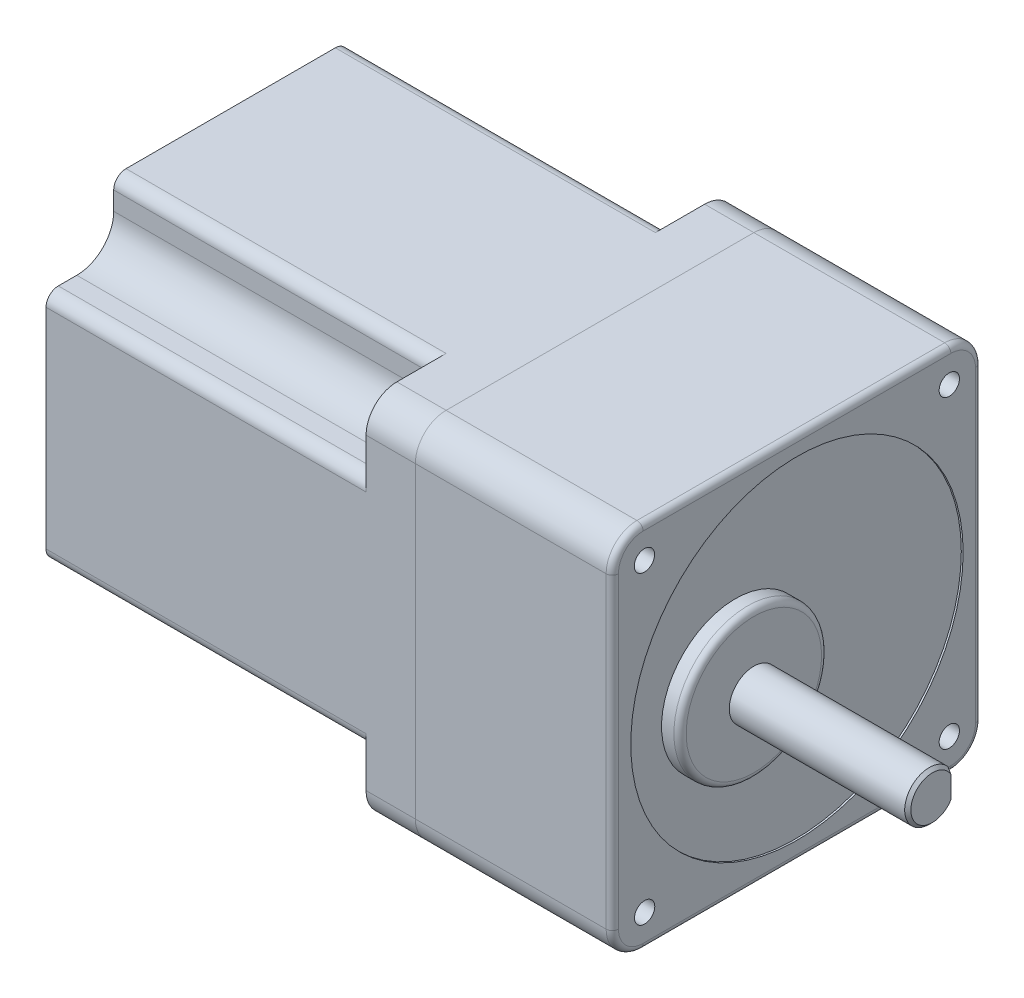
SolidWorks part; units mm, degrees
ref_plane "前视基准面" through (0, 0, 0) normal (0, 0, 1) x (1, 0, 0)
ref_plane "上视基准面" through (0, 0, 0) normal (0, 1, 0) x (1, 0, 0)
ref_plane "右视基准面" through (0, 0, 0) normal (1, 0, 0) x (0, 0, -1)
sketch "草图1" plane through (0, 0, 0) normal (1, 0, 0) x (0, 0, -1)
  line L1 (-25, -30) -> (25, -30)
  line L2 (-30, -25) -> (-30, 25)
  line L3 (-25, 30) -> (25, 30)
  line L4 (30, -25) -> (30, 25)
  line L5 (-30, -30) -> (30, 30) construction
  line L6 (-30, 30) -> (30, -30) construction
  arc A0 (-25, -30) -> (-30, -25) centre (-25, -25) cw
  arc A1 (25, -30) -> (30, -25) centre (25, -25) ccw
  arc A2 (25, 30) -> (30, 25) centre (25, 25) cw
  arc A3 (-30, 25) -> (-25, 30) centre (-25, 25) cw
  point P0 (0, 0)
  dimension "D1" = 5
extrude "凸台-拉伸1" add sketch "草图1" against normal blind 8
sketch "草图3" plane through (0, 0, 0) normal (1, 0, 0) x (0, 0, -1)
  circle A5 centre (-24.7487, 24.7487) radius 3
  circle A6 centre (24.7487, 24.7487) radius 3
  circle A7 centre (24.7487, -24.7487) radius 3
  circle A8 centre (-24.7487, -24.7487) radius 3
extrude "切除-拉伸1" cut sketch "草图3" against normal blind 8
sketch "草图4" plane through (-8, 0, 0) normal (-1, 0, 0) x (0, 0, 1)
  line L0 (-25, 19) -> (-28, 19)
  line L1 (-30, -25) -> (-30, 25) construction
  line L2 (-30, 17) -> (-30, -17)
  line L3 (-25, -19) -> (-28, -19)
  line L4 (-17, -30) -> (17, -30)
  line L5 (-19, -25) -> (-19, -28)
  line L6 (25, -30) -> (-25, -30) construction
  line L7 (30, -17) -> (30, 17)
  line L8 (19, -25) -> (19, -28)
  line L9 (-17, 30) -> (17, 30)
  line L10 (25, -19) -> (28, -19)
  line L11 (30, 25) -> (30, -25) construction
  line L13 (25, 19) -> (28, 19)
  line L15 (19, 25) -> (19, 28)
  line L16 (-25, 30) -> (25, 30) construction
  line L18 (-19, 25) -> (-19, 28)
  arc A0 (-25, 19) -> (-19, 25) centre (-25, 25) ccw
  arc A1 (19, 25) -> (25, 19) centre (25, 25) ccw
  arc A2 (-19, -25) -> (-25, -19) centre (-25, -25) ccw
  arc A3 (25, -19) -> (19, -25) centre (25, -25) ccw
  arc A4 (-19, 28) -> (-17, 30) centre (-17, 28) cw
  arc A5 (19, 28) -> (17, 30) centre (17, 28) ccw
  arc A6 (28, 19) -> (30, 17) centre (28, 17) cw
  arc A7 (28, -19) -> (30, -17) centre (28, -17) ccw
  arc A8 (19, -28) -> (17, -30) centre (17, -28) cw
  arc A9 (-19, -28) -> (-17, -30) centre (-17, -28) ccw
  arc A10 (-28, -19) -> (-30, -17) centre (-28, -17) cw
  arc A11 (-30, 17) -> (-28, 19) centre (-28, 17) cw
  point P7 (-19, 30)
  point P37 (19, 30)
  point P40 (30, 19)
  point P43 (30, -19)
  point P46 (19, -30)
  point P49 (-19, -30)
  point P52 (-30, -19)
  point P55 (-30, 19)
  dimension "D1" = 2
extrude "凸台-拉伸2" add sketch "草图4" along normal blind 52
sketch "草图5" plane through (0, 0, 0) normal (1, 0, 0) x (0, 0, -1)
  line L0 (25, 30) -> (-25, 30) construction
  line L1 (-25, -30) -> (25, -30)
  line L2 (-30, -25) -> (-30, 25)
  line L3 (-25, 30) -> (25, 30)
  line L4 (30, -25) -> (30, 25)
  line L5 (-30, -30) -> (30, 30) construction
  line L6 (-30, 30) -> (30, -30) construction
  arc A0 (-25, -30) -> (-30, -25) centre (-25, -25) cw
  arc A1 (25, -30) -> (30, -25) centre (25, -25) ccw
  arc A2 (25, 30) -> (30, 25) centre (25, 25) cw
  arc A3 (-30, 25) -> (-25, 30) centre (-25, 25) cw
  point P0 (0, 0)
  dimension "D1" = 5
extrude "凸台-拉伸3" add sketch "草图5" along normal blind 32 separate body
sketch "草图6" plane through (32, 0, 0) normal (1, 0, 0) x (0, 0, -1)
  point P19 (-24.7793, 24.7793)
  point P20 (24.7487, 24.7487)
  point P21 (24.7487, -24.7487)
  point P22 (-24.7487, -24.7487)
hole_wizard "M4 螺纹孔1" positions "3D草图1" profile "草图7" tap size "M4" standard "GB"
sketch3d "3D草图1"
  point P0 (32, 24.7793, 24.7793)
  point P3 (32, 24.7487, -24.7487)
  point P6 (32, -24.7487, -24.7487)
  point P9 (32, -24.7487, 24.7487)
sketch "草图7" plane through (32, 24.7793, 24.7793) normal (0, 1, 0) x (0, 0, -1)
  line L0 (0, 0) -> (0, 12.9914)
  line L1 (0, 12.9914) -> (1.65, 12)
  line L2 (1.65, 12) -> (1.65, 0)
  line L5 (1.65, 0) -> (0, 0)
  line L10 (0, 12.9914) -> (-1.65, 12) construction
  line L11 (0, -6.35) -> (0, 107.95) construction
  dimension "螺纹孔钻头直径" = 3.3
  dimension "螺纹孔钻头深度" = 12
  dimension "导头角度" = 118
sketch "草图8" plane through (0, 0, 0) normal (-1, 0, 0) x (0, 0, 1)
  circle A0 centre (-24.7487, 24.7487) radius 3
  circle A1 centre (24.7487, 24.7487) radius 3
  circle A2 centre (24.7487, -24.7487) radius 3
  circle A3 centre (-24.7487, -24.7487) radius 3
extrude "切除-拉伸2" cut sketch "草图8" against normal blind 20
sketch "草图9" plane through (32, 0, 0) normal (1, 0, 0) x (0, 0, -1)
  circle A0 centre (-10, 0) radius 12
extrude "凸台-拉伸4" add sketch "草图9" along normal blind 3
fillet "圆角1" radius 1 1 edges at (35, 0, -2)
sketch "草图10" plane through (35, 0, 0) normal (1, 0, 0) x (0, 0, -1)
  circle A0 centre (-10, 0) radius 4
extrude "凸台-拉伸5" add sketch "草图10" along normal blind 29
sketch "草图11" plane through (64, 0, 0) normal (1, 0, 0) x (0, 0, -1)
  line L2 (-7, 2.6458) -> (-7, -2.6458)
  arc A0 (-7, -2.6458) -> (-7, 2.6458) centre (-10, 0) ccw
extrude "切除-拉伸3" cut sketch "草图11" against normal blind 25
chamfer "倒角1" distance 0.5 angle 45 1 edges at (64, 0, 14)
sketch "草图12" plane through (32, 0, 0) normal (1, 0, 0) x (0, 0, -1)
  circle A0 centre (0, 0) radius 27
extrude "切除-拉伸4" cut sketch "草图12" against normal blind 0.3
fillet "圆角2" radius 1 8 edges at (32, -28.5355, 28.5355) (32, -30, 0) (32, -28.5355, -28.5355) (32, 0, -30) (32, 28.5355, -28.5355) (32, 30, 0) (32, 0, 30) (32, 28.5355, 28.5355)
